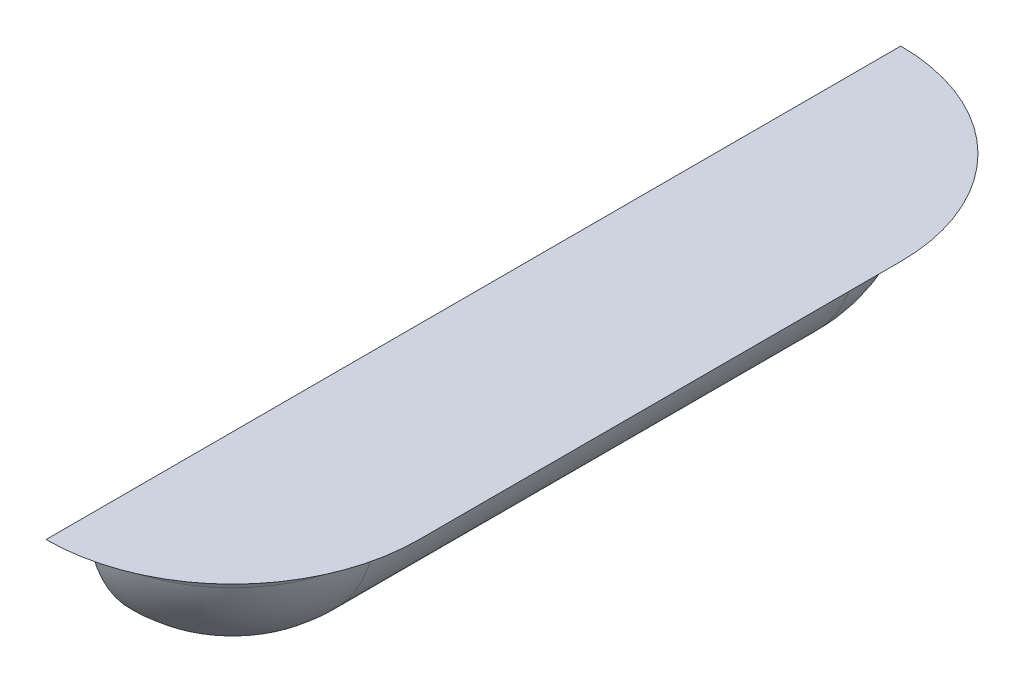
SolidWorks part; units mm, degrees
ref_plane "Plane1" through (0, 0, 0) normal (0, 0, 1) x (1, 0, 0)
ref_plane "Plane2" through (0, 0, 0) normal (0, 1, 0) x (1, 0, 0)
ref_plane "Plane3" through (0, 0, 0) normal (1, 0, 0) x (0, 0, -1)
sketch "Sketch1" plane through (0, 0, 0) normal (0, 0, 1) x (1, 0, 0)
  line L0 (-15, 0) -> (15, 0)
  line L1 (-15, 0) -> (-15, 3.4642)
  line L2 (15, 3.4642) -> (-15, 3.4642)
  line L3 (15, 3.4642) -> (15, 0)
  line L4 (0, 0) -> (0, 3.4642) construction
  line L5 (50, 0) -> (-50, 0) construction
  dimension "D1" = 30
extrude "Base-Extrude" add sketch "Sketch1" along normal mid plane 50
sketch "Layout Sketch" plane through (0, 0, 0) normal (0, -1, 0) x (1, 0, 0)
  line L0 (-6.5173, 0) -> (7.2244, 0) construction
  line L1 (11.2638, 0) -> (-11.2638, 0) construction
  line L2 (0, 9.1132) -> (0, -7.6236) construction
  line L3 (0, -50) -> (0, 50) construction
  line L9 (-3, -16) -> (-3, 16)
  line L11 (3, 10) -> (3, -10)
  arc A0 (3, 10) -> (-3, 16) centre (-3, 10) ccw
  arc A1 (3, -10) -> (-3, -16) centre (-3, -10) cw
sketch "Louver Body" plane through (0, 0, 0) normal (0, 0, 1) x (1, 0, 0)
  line L0 (-3, 0) -> (-3, -6)
  line L1 (-15, 0) -> (15, 0) construction
  line L2 (-3, 0) -> (3, 0)
  line L4 (3, 0) -> (3, 3.4642) construction
  line L5 (15, 3.4642) -> (-15, 3.4642) construction
  line L6 (-3, -6) -> (-3.0249, -6) construction
  line L8 (0, 3.4642) -> (0, 0) construction
  arc A0 (-3, -6) -> (3, 0) centre (-3, 0) ccw
extrude "Boss-Extrude1" add sketch "Louver Body" along normal mid plane 20
sketch "Sketch12" plane through (0, 0, 10) normal (0, 0, 1) x (1, 0, 0)
  line L0 (-3, 0) -> (-3, -6) construction
  line L1 (-3, 0) -> (-3, -6) construction
  line L2 (-15, 0) -> (15, 0) construction
  line L5 (3, 0) -> (-3, 0)
  line L6 (-3, 0) -> (-3, -6)
  line L7 (3, 0) -> (-3, 0)
  line L8 (-3, 0) -> (-3, -6)
  arc A0 (-3, -6) -> (3, 0) centre (-3, 0) ccw construction
  arc A2 (-3, -6) -> (3, 0) centre (-3, 0) ccw
  arc A3 (-3, -6) -> (3, 0) centre (-3, 0) ccw
  dimension "D1" = 0
revolve "Boss-Revolve2" add sketch "Sketch12" angle 90 about L1
sketch "Sketch13" plane through (0, 0, -10) normal (0, 0, -1) x (-1, 0, 0)
  line L0 (3, -6) -> (3, 0) construction
  line L1 (15, 0) -> (-15, 0) construction
  line L2 (3, 0) -> (-3, 0)
  line L3 (3, -6) -> (3, 0)
  line L4 (3, 0) -> (-3, 0)
  line L5 (3, -6) -> (3, 0)
  arc A1 (-3, 0) -> (3, -6) centre (3, 0) ccw
  arc A2 (-3, 0) -> (3, -6) centre (3, 0) ccw
  dimension "D1" = 0
revolve "Boss-Revolve3" add sketch "Sketch13" angle 90 about L0
fillet "Fillet1" radius 2 3 edges at (3, 0, 0) (1.2426, 0, 14.2426) (1.2426, 0, -14.2426)
sketch "Sketch8" plane through (-15, 0, 0) normal (-1, 0, 0) x (0, 0, 1)
  line L4 (-25, 0) -> (25, 0)
  line L5 (25, 0) -> (25, 3.4642)
  line L6 (25, 3.4642) -> (-25, 3.4642)
  line L7 (-25, 3.4642) -> (-25, 0)
  line L8 (-25, 0) -> (25, 0)
  line L9 (25, 0) -> (25, 3.4642)
  line L10 (25, 3.4642) -> (-25, 3.4642)
  line L11 (-25, 3.4642) -> (-25, 0)
  dimension "D1" = 0
extrude "Cut-Extrude4" cut sketch "Sketch8" against normal through all
sketch "Orientation sketch" plane through (0, 0, 0) normal (0, 1, 0) x (-1, 0, 0)
  line L2 (3, 17.746) -> (3, -17.746)
  line L3 (3, 17.746) -> (3, -17.746)
  line L4 (-4.746, 10) -> (-4.746, -10)
  line L5 (-4.746, 10) -> (-4.746, -10)
  arc A2 (3, 17.746) -> (-4.746, 10) centre (3, 10) ccw
  arc A3 (3, 17.746) -> (-4.746, 10) centre (3, 10) ccw
  arc A4 (-4.746, -10) -> (3, -17.746) centre (3, -10) ccw
  arc A5 (-4.746, -10) -> (3, -17.746) centre (3, -10) ccw
  dimension "D1" = 0
equation "\"Width@Boss-Extrude1\"=\"Overall width@Layout Sketch\"-2*\"Depth@Layout Sketch\""
